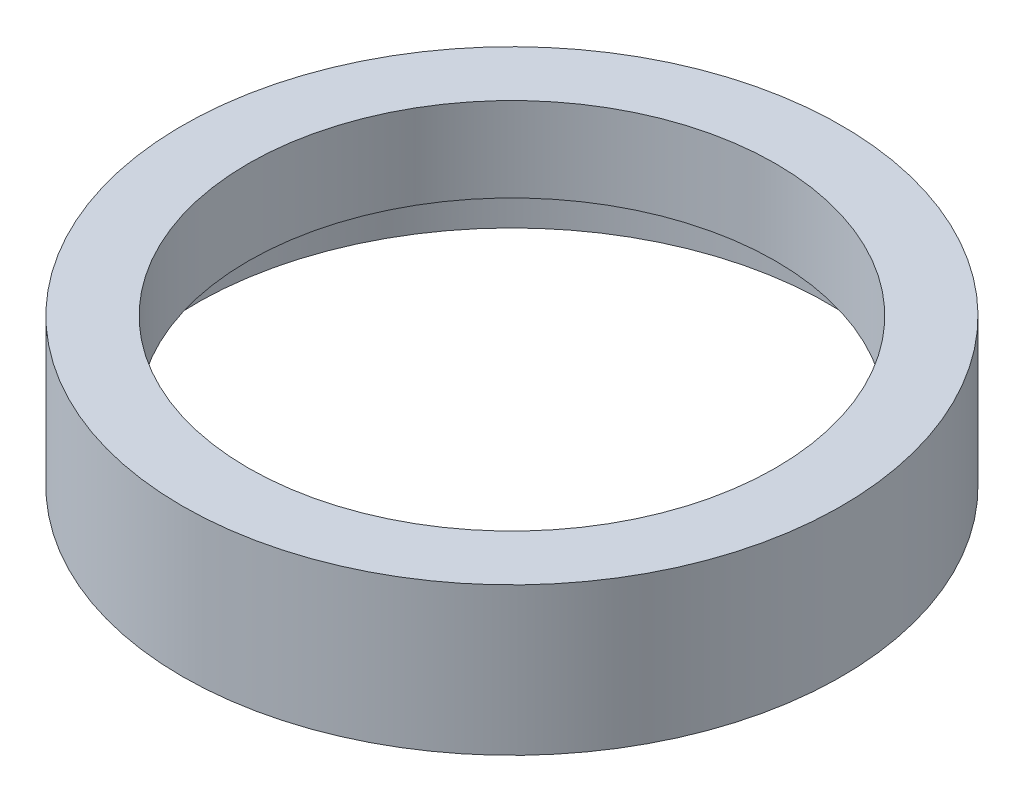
SolidWorks part; units mm, degrees
ref_plane "Front Plane" through (0, 0, 0) normal (0, 0, 1) x (1, 0, 0)
ref_plane "Top Plane" through (0, 0, 0) normal (0, 1, 0) x (1, 0, 0)
ref_plane "Right Plane" through (0, 0, 0) normal (1, 0, 0) x (0, 0, -1)
sketch "Sketch1" plane through (0, 0, 0) normal (0, 1, 0) x (1, 0, 0)
  circle A0 centre (0, 0) radius 60
  circle A1 centre (0, 0) radius 62.5
  dimension "D1" = 120
  dimension "D2" = 125
extrude "Boss-Extrude1" add sketch "Sketch1" along normal blind 18
sketch "Sketch2" plane through (0, 18, 0) normal (0, 1, 0) x (1, 0, 0)
  circle A0 centre (0, 0) radius 62.5
  circle A1 centre (0, 0) radius 50
  dimension "D1" = 125
  dimension "D2" = 100
extrude "Boss-Extrude2" add sketch "Sketch2" along normal blind 10
sketch "Sketch3" plane through (0, 18, 0) normal (0, -1, 0) x (1, 0, 0)
  circle A0 centre (0, 0) radius 50
  circle A1 centre (0, 0) radius 54
  dimension "D1" = 100
  dimension "D2" = 108
extrude "Boss-Extrude3" add sketch "Sketch3" along normal blind 6
